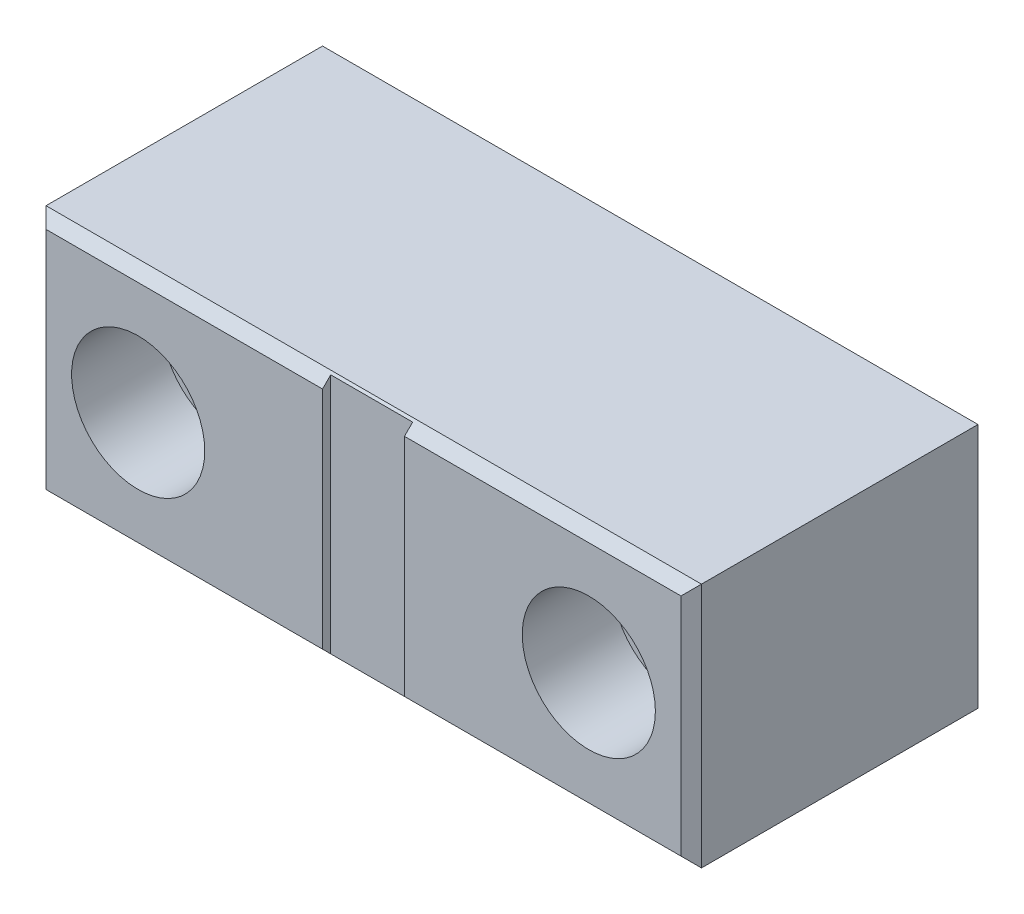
SolidWorks part; units mm, degrees
ref_plane "Front" through (0, 0, 0) normal (0, 0, 1) x (1, 0, 0)
ref_plane "Top" through (0, 0, 0) normal (0, 1, 0) x (1, 0, 0)
ref_plane "Right" through (0, 0, 0) normal (1, 0, 0) x (0, 0, -1)
sketch "Sketch1" plane through (0, 0, -44.45) normal (0, 0, 1) x (1, 0, 0)
  line L0 (-838.2, -204.8274) -> (-838.2, -372.7655) construction
  line L1 (-889, -222.25) -> (-787.4, -222.25)
  line L2 (-889, -222.25) -> (-889, -260.35)
  line L3 (-889, -260.35) -> (-787.4, -260.35)
  line L4 (-787.4, -222.25) -> (-787.4, -260.35)
  line L5 (-1219.2, -304.8) -> (0, -304.8) construction
  line L7 (-857.25, 304.8) -> (-857.25, 129.3243) construction
  line L8 (-819.15, -304.8) -> (-819.15, 304.8) construction
  dimension "Logo3p1_Width" = 101.6
  dimension "Logo3p2_Depth" = 38.1
  dimension "Logo3p4_1st Instance Inset" = 44.45
extrude "Boss-Extrude1" add sketch "Sketch1" along normal blind 44.45 separate body
hole_wizard "CBORE for 1/2 Socket Head Cap Screw1" positions "Sketch4" profile "Sketch5" counterbore size "1/2" standard "ANSI Inch"
sketch "Sketch4" plane through (0, 0, 0) normal (0, 0, 1) x (1, 0, 0)
  line L0 (-838.2, -222.25) -> (-838.2, -260.35) construction
  line L1 (-787.4, -222.25) -> (-889, -222.25) construction
  line L2 (-889, -260.35) -> (-787.4, -260.35) construction
  line L3 (-838.2, -241.3) -> (-873.125, -241.3) construction
  line L4 (-889, -222.25) -> (-889, -260.35) construction
  point P0 (-873.125, -241.3)
  point P2 (-803.275, -241.3)
  dimension "D1" = 15.875
sketch "Sketch5" plane through (-873.125, -241.3, 0) normal (1, 0, 0) x (0, -1, 0)
  line L0 (0, 0) -> (0, 44.45)
  line L1 (0, 44.45) -> (6.7462, 44.45)
  line L3 (6.7462, 44.45) -> (6.7462, 13.97)
  line L4 (6.7462, 13.97) -> (10.3187, 13.97)
  line L5 (10.3187, 13.97) -> (10.3187, 0)
  line L7 (10.3187, 0) -> (0, 0)
  line L11 (0, -6.35) -> (0, 107.95) construction
  dimension "Thru Hole Dia." = 13.4925
  dimension "Thru Hole Depth" = 44.45
  dimension "C'Bore Dia." = 20.6375
  dimension "C'Bore Depth" = 13.97
chamfer "Chamfer1" distance 1.5875 angle 45 4 edges at (-838.2, -222.25, 0) (-787.4, -241.3, 0) (-838.2, -260.35, 0) (-889, -241.3, 0)
sketch "Sketch2" plane through (0, 0, 0) normal (0, 0, 1) x (1, 0, 0)
  line L0 (-787.4, -222.25) -> (-889, -222.25) construction
  line L1 (-844.55, -222.25) -> (-831.85, -222.25)
  line L2 (-844.55, -222.25) -> (-844.55, -260.35)
  line L3 (-844.55, -260.35) -> (-831.85, -260.35)
  line L4 (-831.85, -222.25) -> (-831.85, -260.35)
  line L5 (-889, -260.35) -> (-787.4, -260.35) construction
  line L6 (-838.2, -260.35) -> (-838.2, -222.25) construction
  line L9 (-787.4, -222.25) -> (-787.4, -260.35) construction
  line L10 (-889, -260.35) -> (-889, -222.25) construction
  dimension "Logo3p5_Groove Width" = 12.7
extrude "Cut-Extrude1" cut sketch "Sketch2" against normal blind 1.27
sketch "Sketch3" plane through (0, -260.35, 0) normal (0, -1, 0) x (1, 0, 0)
  line L0 (-889, -19.05) -> (-787.4, -19.05) construction
  line L1 (-889, -1.5875) -> (-889, -44.45) construction
  line L2 (-787.4, -1.5875) -> (-787.4, -44.45) construction
  line L3 (-887.4125, 0) -> (-844.55, 0) construction
  text T0 "0.05"
  dimension "D1" = 19.05
extrude "Cut-Extrude2" cut sketch "Sketch3" against normal blind 0.127
ref_plane "Plane1" through (-838.2, 0, 0) normal (1, 0, 0) x (0, 0, -1)
equation "\"GrooveDepth\"=0.05"
equation "\"Logo3p6_Groove Depth@Cut-Extrude1\"= \"GrooveDepth\""
